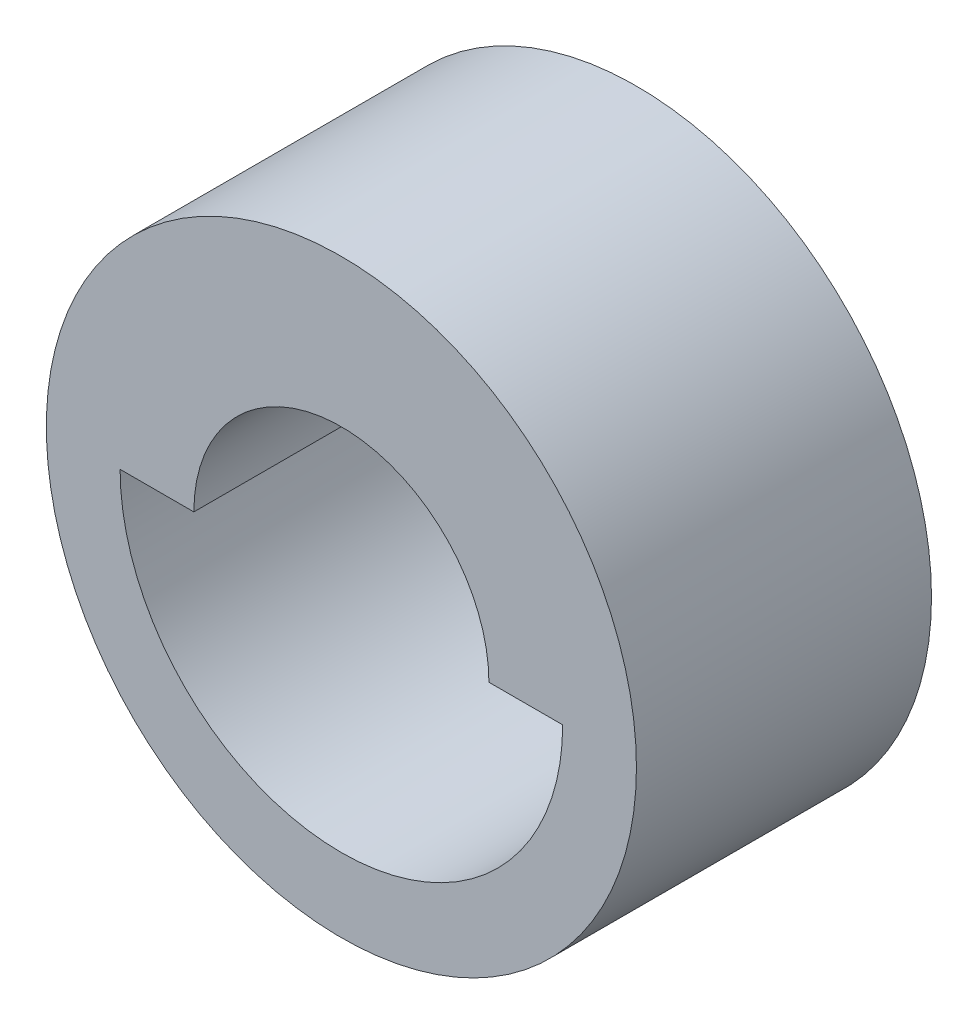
SolidWorks part; units mm, degrees
ref_plane "Front Plane" through (0, 0, 0) normal (0, 0, 1) x (1, 0, 0)
ref_plane "Top Plane" through (0, 0, 0) normal (0, 1, 0) x (1, 0, 0)
ref_plane "Right Plane" through (0, 0, 0) normal (1, 0, 0) x (0, 0, -1)
sketch "Sketch1" plane through (0, 0, 0) normal (0, 0, 1) x (1, 0, 0)
  circle A0 centre (0, 0) radius 50.8
  circle A1 centre (0, 0) radius 25.4
  dimension "D1" = 50.8
extrude "Boss-Extrude1" add sketch "Sketch1" along normal blind 50.8
sketch "Sketch2" plane through (0, 0, 0) normal (0, 1, 0) x (1, 0, 0)
  line L1 (38.1, -50.8) -> (25.4, -50.8)
  line L2 (38.1, -50.8) -> (38.1, 0)
  line L3 (38.1, 0) -> (25.4, 0)
  line L4 (25.4, -50.8) -> (25.4, 0)
  line L5 (25.4, -50.8) -> (25.4, 0) construction
  line L6 (0, -65.2806) -> (0, 14.4922) construction
  point P4 (0, -25.3942)
  dimension "D1" = 12.7
  dimension "D2" = 0
  dimension "D3" = 25.4
revolve "Cut-Revolve1" cut sketch "Sketch2" angle 180 about L6
